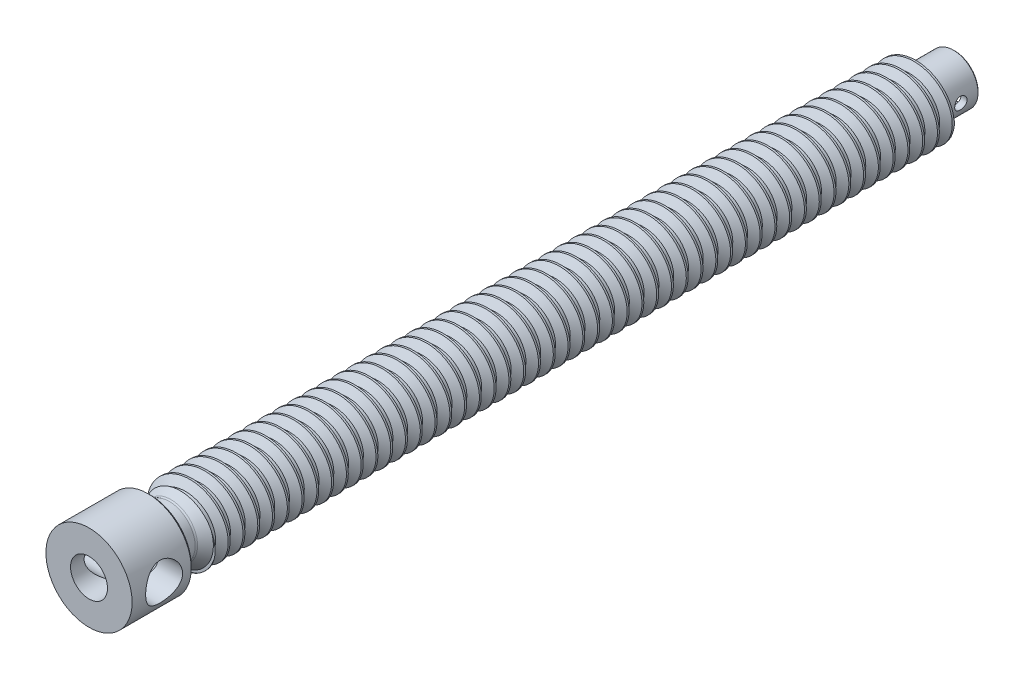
SolidWorks part; units mm, degrees
ref_plane "Спереди" through (0, 0, 0) normal (0, 0, 1) x (1, 0, 0)
ref_plane "Сверху" through (0, 0, 0) normal (0, 1, 0) x (1, 0, 0)
ref_plane "Справа" through (0, 0, 0) normal (1, 0, 0) x (0, 0, -1)
sketch "Эскиз1" plane through (0, 0, 0) normal (0, 1, 0) x (1, 0, 0)
  line L0 (17.5, -165) -> (0, -165)
  line L1 (0, -165) -> (0, -190)
  line L2 (0, -190) -> (17.5, -190)
  line L3 (17.5, -190) -> (17.5, -165)
  line L4 (0, -165) -> (0, -190) construction
revolve "Повернуть1" add sketch "Эскиз1" angle 360 about L4
sketch "Эскиз2" plane through (0, 0, 165) normal (0, 0, -1) x (-1, 0, 0)
  circle A0 centre (0, 0) radius 10.5
extrude "Бобышка-Вытянуть1" add sketch "Эскиз2" along normal blind 8
sketch "Эскиз3" plane through (0, 0, 157) normal (0, 0, -1) x (-1, 0, 0)
  circle A0 centre (0, 0) radius 10.5
extrude "Бобышка-Вытянуть2" add sketch "Эскиз3" along normal blind 3.5 draft 45
sketch "Эскиз4" plane through (0, 0, 153.5) normal (0, 0, -1) x (-1, 0, 0)
  circle A0 centre (0, 0) radius 15
extrude "Бобышка-Вытянуть3" add sketch "Эскиз4" along normal blind 300
sketch "Эскиз5" plane through (0, 0, -146.5) normal (0, 0, -1) x (-1, 0, 0)
  circle A0 centre (0, 0) radius 14
extrude "Бобышка-Вытянуть4" add sketch "Эскиз5" along normal blind 0.2096 draft 87
sketch "Эскиз6" plane through (0, 0, -146.7096) normal (0, 0, -1) x (-1, 0, 0)
  circle A0 centre (0, 0) radius 10
extrude "Бобышка-Вытянуть5" add sketch "Эскиз6" along normal blind 14.7904
hole_wizard "Отверстие с зазором 9/161" positions "Трехмерный эскиз1" profile "Эскиз7" hole size "9/16" standard "Ansi Inch"
sketch3d "Трехмерный эскиз1"
  point P0 (17.5, 0, 177)
sketch "Эскиз7" plane through (17.5, 0, 177) normal (0, 1, 0) x (0, 0, -1)
  line L0 (0, 0) -> (0, 35)
  line L1 (0, 35) -> (7.5, 35)
  line L2 (7.5, 35) -> (7.5, 0)
  line L5 (7.5, 0) -> (0, 0)
  line L11 (0, -6.35) -> (0, 107.95) construction
  dimension "Диаметр сквозного отверстия" = 15
  dimension "Глубина сквозного отверстия" = 35
hole_wizard "Отверстие с зазором 9/162" positions "Эскиз10" profile "Эскиз9" hole size "9/16" standard "Ansi Inch"
sketch "Эскиз10" plane through (0, 0, 190) normal (0, 0, 1) x (1, 0, 0)
  point P0 (0, 0)
sketch "Эскиз9" plane through (0, 0, 190) normal (1, 0, 0) x (0, -1, 0)
  line L0 (0, 0) -> (0, 367)
  line L1 (0, 367) -> (7.5, 367)
  line L2 (7.5, 367) -> (7.5, 0)
  line L5 (7.5, 0) -> (0, 0)
  line L10 (0, 367) -> (-7.5, 367) construction
  line L11 (0, -6.35) -> (0, 107.95) construction
  dimension "Диаметр отверстия" = 15
  dimension "Глубина отверстия" = 367
  dimension "Угол заточки сверла" = 180
chamfer "Фаска1" distance 0.5 angle 45 2 edges at (-7.5, 0, -161.5) (-10, 0, -161.5)
chamfer "Фаска2" distance 1 angle 45 1 edges at (17.5, 0, 165)
fillet "Скругление1" radius 1 1 edges at (-10.5, 0, 157)
fillet "Скругление2" radius 2 1 edges at (-10.5, 0, 165)
thread "Резьба1" pitch 6 start angle 0, offset 5, length 300, pitch 6, diameter 30
ref_plane "Плоскость1" through (15, 0, -151.5) normal (0, -1, 0) x (1, 0, 0)
sketch "Профиль резьбы1" plane through (15, 0, -151.5) normal (0, -1, 0) x (1, 0, 0)
  line L0 (0, 0) -> (0, 6) construction
  line L11 (0, 0) -> (0, 5.25)
  line L12 (0, 5.25) -> (-3.2476, 3.375)
  line L13 (-3.2476, 3.375) -> (-3.2476, 1.875)
  line L15 (-3.2476, 1.875) -> (0, 0)
  line L17 (-3.2476, 2.625) -> (0, 2.625) construction
  point P2 (0, 0)
  dimension "Pitch" = 6
  dimension "Profile_Angle" = 60
  dimension "Profile_Land" = 1.5
  dimension "Profile_Height" = 3.2476
hole_wizard "Отверстие обработанное метчиком M61" positions "Трехмерный эскиз3" profile "Эскиз12" tap size "M6" standard "GOST"
sketch3d "Трехмерный эскиз3"
  point P0 (9.9934, -0.363, -154.0345)
sketch "Эскиз12" plane through (9.9934, -0.363, -154.0345) normal (0, 0, 1) x (0.0363, 0.9993, 0)
  line L0 (0, 0) -> (0, 18.5022)
  line L1 (0, 18.5022) -> (2.5, 17)
  line L2 (2.5, 17) -> (2.5, 0)
  line L5 (2.5, 0) -> (0, 0)
  line L10 (0, 18.5022) -> (-2.5, 17) construction
  line L11 (0, -6.35) -> (0, 107.95) construction
  dimension "Диаметр сверла" = 5
  dimension "Глубина сверла" = 17
  dimension "Угол заточки сверла" = 118
